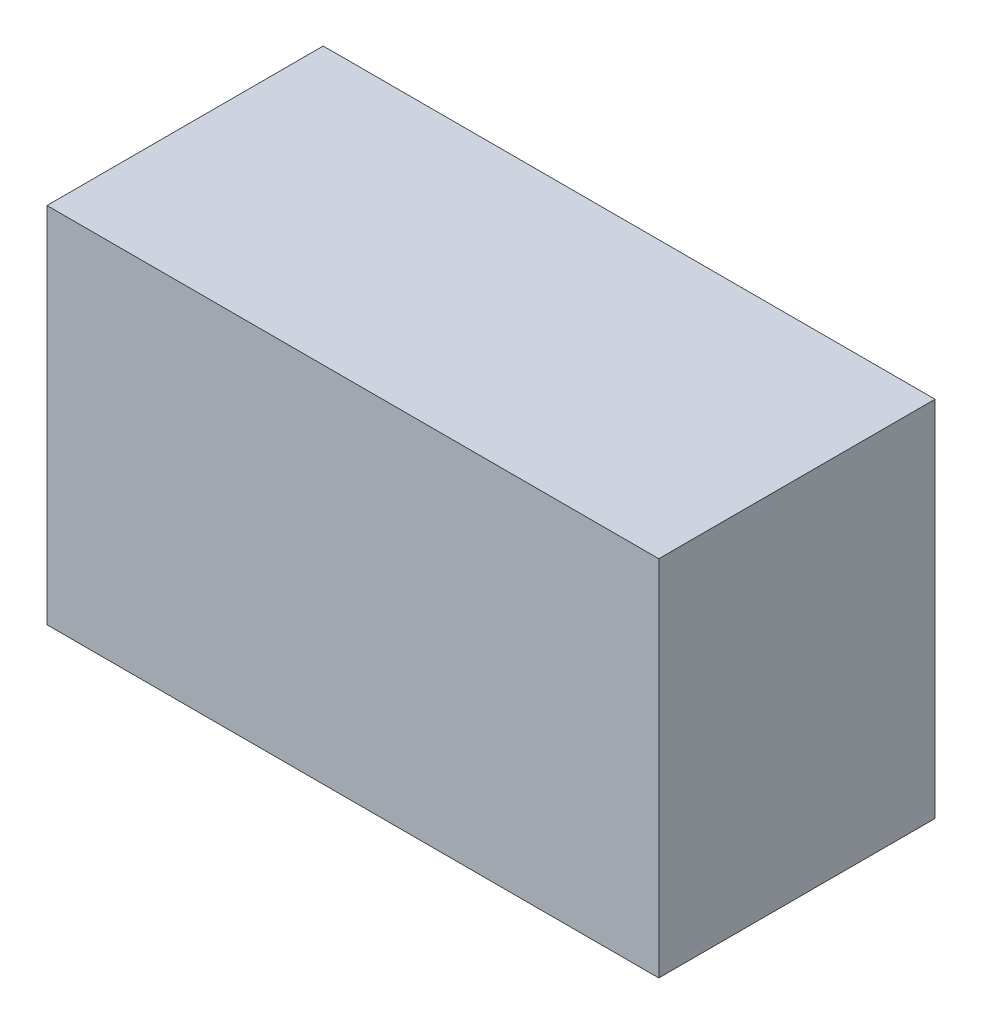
SolidWorks part; units mm, degrees
ref_plane "Front Plane" through (0, 0, 0) normal (0, 0, 1) x (1, 0, 0)
ref_plane "Top Plane" through (0, 0, 0) normal (0, 1, 0) x (1, 0, 0)
ref_plane "Right Plane" through (0, 0, 0) normal (1, 0, 0) x (0, 0, -1)
sketch "Sketch1" plane through (0, 0, 0) normal (0, 0, 1) x (1, 0, 0)
  line L1 (-36.5823, 17.4422) -> (39.3607, 17.4422)
  line L2 (-36.5823, 17.4422) -> (-36.5823, -27.6297)
  line L3 (-36.5823, -27.6297) -> (39.3607, -27.6297)
  line L4 (39.3607, 17.4422) -> (39.3607, -27.6297)
extrude "Extrude1" add sketch "Sketch1" along normal blind 34.29
